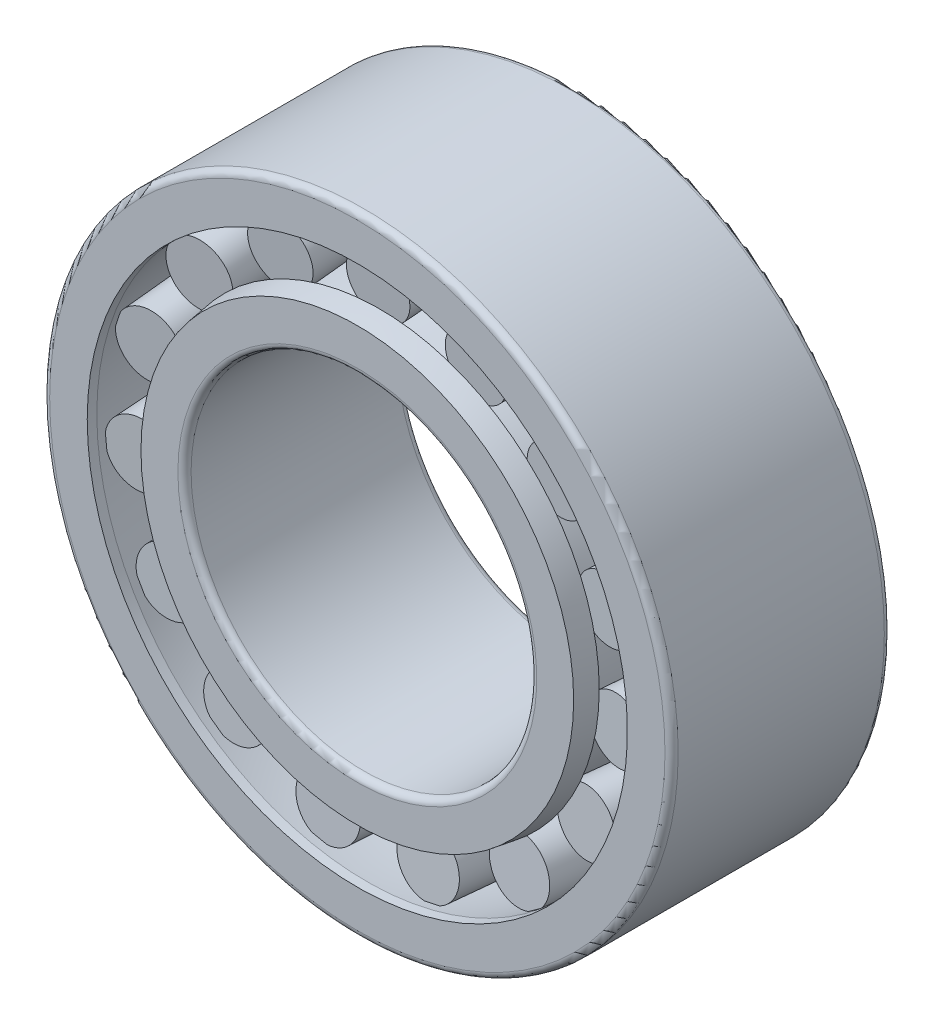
SolidWorks part; units mm, degrees
ref_plane "Front Plane" through (0, 0, 0) normal (0, 0, 1) x (1, 0, 0)
ref_plane "Top Plane" through (0, 0, 0) normal (0, 1, 0) x (1, 0, 0)
ref_plane "Right Plane" through (0, 0, 0) normal (1, 0, 0) x (0, 0, -1)
other "Configuration Table"
sketch "BaseSke" plane through (0, 0, 0) normal (1, 0, 0) x (0, 0, -1)
  line L0 (-47.2296, 0) -> (69.4868, 0) construction
  line L2 (0, 129.5214) -> (0, 88.1749) construction
  line L3 (-34.9, 55) -> (-34.9, 68.8462) construction
  line L4 (-34.9, 100) -> (34.9, 100) construction
  line L5 (-34.9, 55) -> (34.9, 55) construction
  line L7 (34.9, 55) -> (34.9, 68.8462) construction
  line L8 (34.9, 85.4615) -> (34.9, 100) construction
  line L9 (-34.9, 85.4615) -> (-34.9, 100) construction
  line L11 (0, 79.975) -> (-34.9, 77.1538) construction
  line L12 (0, 79.975) -> (34.9, 77.1538) construction
  line L13 (-34.9, 85.4615) -> (-34.9, 68.8462) construction
  line L14 (0, 71.775) -> (0, -86.3012) construction
  line L15 (0, 88.1749) -> (0, 71.775) construction
  line L16 (-28.2719, 76.5225) -> (-27.4605, 66.4845) construction
  line L17 (-29.0833, 86.5605) -> (-5.8923, 88.4351)
  line L18 (-29.0833, 86.5605) -> (-28.2719, 76.5225)
  line L19 (-27.4605, 66.4845) -> (-4.2695, 68.3591) construction
  line L20 (-5.8923, 88.4351) -> (-5.0809, 78.3971)
  line L21 (-4.2695, 68.3591) -> (-5.0809, 78.3971) construction
  line L22 (-28.2719, 76.5225) -> (-5.0809, 78.3971)
  line L23 (-34.9, 75.9867) -> (0, 78.8078) construction
  arc A1 (-34.9, 85.4615) -> (34.9, 85.4615) centre (0, -137.625) cw construction
  arc A2 (34.9, 68.8462) -> (-34.9, 68.8462) centre (0, -137.625) ccw construction
revolve "Roller" add sketch "BaseSke" angle 360 about L23
sketch "OuterRaceSke" plane through (0, 0, 0) normal (1, 0, 0) x (0, 0, -1)
  line L0 (0, 0) -> (0, 94.5438) construction
  line L1 (-34.9, 100) -> (34.9, 100)
  line L2 (-34.9, 100) -> (-34.9, 85.4413)
  line L3 (34.9, 100) -> (34.9, 85.4413)
  line L5 (-50.3916, 0) -> (55.2197, 0) construction
  arc A0 (-34.9, 85.4413) -> (34.9, 85.4413) centre (0, -137.625) cw
  arc A2 (34.9, 85.4615) -> (-34.9, 85.4615) centre (0, -137.625) ccw construction
  dimension "D1" = 0.02
revolve "OuterRace" add sketch "OuterRaceSke" angle 360 about L5
sketch "InnerRaceSke" plane through (0, 0, 0) normal (1, 0, 0) x (0, 0, -1)
  line L0 (-70.8626, 0) -> (113.5527, 0) construction
  line L1 (0, 90.393) -> (0, -90.393) construction
  line L2 (-34.9, 55) -> (34.9, 55)
  line L3 (-34.9, 55) -> (-34.9, 68.8462)
  line L4 (-27.8382, 69.9163) -> (-27.5618, 66.4963)
  line L5 (-27.5618, 66.4963) -> (-4.1714, 68.3871)
  line L7 (-4.1714, 68.3871) -> (-4.4415, 71.7279)
  line L8 (-28.2719, 76.5225) -> (-27.4605, 66.4845) construction
  line L9 (4.1714, 68.3871) -> (4.4415, 71.7279)
  line L10 (-4.2695, 68.3591) -> (-5.0809, 78.3971) construction
  line L11 (-27.4605, 66.4845) -> (-4.2695, 68.3591) construction
  line L14 (27.5618, 66.4963) -> (4.1714, 68.3871)
  line L15 (27.8382, 69.9163) -> (27.5618, 66.4963)
  line L16 (34.9, 55) -> (34.9, 68.8462)
  arc A0 (-34.9, 68.8462) -> (-27.8382, 69.9163) centre (0, -137.625) cw
  arc A1 (34.9, 68.8462) -> (-34.9, 68.8462) centre (0, -137.625) ccw construction
  arc A2 (-4.4415, 71.7279) -> (4.4415, 71.7279) centre (0, -137.625) cw
  arc A3 (34.9, 68.8462) -> (27.8382, 69.9163) centre (0, -137.625) ccw
  point P38 (0, 55)
  dimension "D2" = 0.1
  dimension "D1" = 0.02
  dimension "D3" = 0.1
revolve "InnerRace" add sketch "InnerRaceSke" angle 360 about L0
mirror "MirrorRoller" about plane through (0, 0, 0) normal (0, 0, 1) of "Roller"
fillet "Fillet1" radius 2.1 4 edges at (55, 0, 34.9) (100, 0, 34.9) (55, 0, -34.9) (100, 0, -34.9)
sketch "CutGrooveSke" plane through (0, 0, 0) normal (1, 0, 0) x (0, 0, -1)
  line L0 (-51.8407, 0) -> (83.8302, 0) construction
  line L1 (-17.45, -118) -> (-20.94, -118)
  line L2 (-17.45, -118) -> (-17.45, -98)
  line L3 (-17.45, -98) -> (-20.94, -98)
  line L4 (-20.94, -118) -> (-20.94, -98)
revolve "CutGroove" [suppressed] cut sketch "CutGrooveSke" angle 360 about L0
sketch "TaperSke" plane through (0, 0, 0) normal (1, 0, 0) x (0, 0, -1)
  line L0 (-34.9, 55) -> (34.9, 55)
  line L1 (34.9, 55) -> (34.9, 60.8167)
  line L2 (34.9, 60.8167) -> (-34.9, 55)
  line L7 (-41.2502, 0) -> (40.8606, 0) construction
revolve "Taper" [suppressed] cut sketch "TaperSke" angle 360 about L7
fillet "Fillet2" [suppressed] radius 2.1
pattern_circular "CirPatternBall" count 15 over 360 about axis through (0, 0, 0) along (0, 0, 1) of "Roller", "MirrorRoller"
sketch "SimplifiedSke" plane through (0, 0, 0) normal (1, 0, 0) x (0, 0, -1)
  line L0 (37.5911, 0) -> (-37.5911, 0) construction
  line L1 (0, 0) -> (0, 96.8272) construction
  line L2 (-27.4605, 66.4845) -> (-4.2695, 68.3591)
  line L3 (-27.4605, 66.4845) -> (-29.0833, 86.5605)
  line L4 (-29.0833, 86.5605) -> (-5.8923, 88.4351)
  line L5 (-4.2695, 68.3591) -> (-5.8923, 88.4351)
  line L7 (4.2695, 68.3591) -> (5.8923, 88.4351)
  line L8 (27.4605, 66.4845) -> (4.2695, 68.3591)
  line L9 (27.4605, 66.4845) -> (29.0833, 86.5605)
  line L10 (29.0833, 86.5605) -> (5.8923, 88.4351)
revolve "Simplified" [suppressed] add sketch "SimplifiedSke" angle 360 about L0
chamfer "Chamfer" distance 2.9083 angle 10 2 edges at (85.4413, 0, -34.9) (85.4413, 0, 34.9)
equation "\"D1@BaseSke\" = \"Bearing_Thickness@BaseSke\"*3"
equation "\"D2@BaseSke\" =  ( \"Bearing_Outside_Diameter@BaseSke\" - \"Bearing_Inside_Diameter@BaseSke\" ) /6.5"
equation "\"D3@BaseSke\" = \"D2@BaseSke\"*1.05"
equation "\"D4@BaseSke\" = \"Bearing_Thickness@BaseSke\"/3"
equation "\"D5@BaseSke\" = \"Bearing_Thickness@BaseSke\"/12"
equation "\"D6@BaseSke\" = \"Bearing_Thickness@BaseSke\"/60"
equation "\"D1@CutGrooveSke\" = \"Bearing_Outside_Diameter@BaseSke\" * 0.49"
equation "\"D2@CutGrooveSke\" = \"Bearing_Thickness@BaseSke\" *0.25"
equation "\"D3@CutGrooveSke\" = \"Bearing_Thickness@BaseSke\"/20"
equation "\"Taper@TaperSke\" = \"Bearing_Thickness@BaseSke\"/12"
equation "\"D1@Fillet2\" = \"Fillet_radius@Fillet1\""
equation "\"D1@CirPatternBall\" =  int(  ( \"Bearing_Outside_Diameter@BaseSke\" + \"Bearing_Inside_Diameter@BaseSke\" )  / 2 *  pi  /  ( \"Bearing_Outside_Diameter@BaseSke\" - \"Bearing_Inside_Diameter@BaseSke\" ) * 2.8 "
equation "\"D1@Chamfer\" = \"Bearing_Thickness@BaseSke\"/24"
